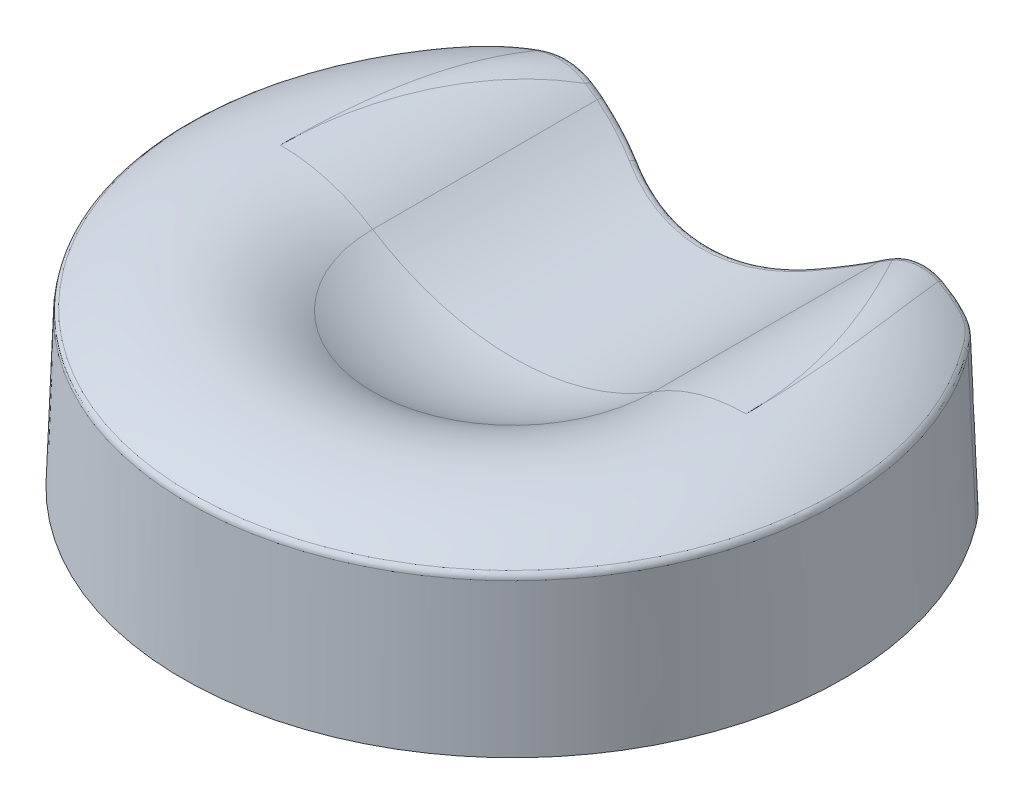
SolidWorks part; units mm, degrees
ref_plane "Front Plane" through (0, 0, 0) normal (0, 0, 1) x (1, 0, 0)
ref_plane "Top Plane" through (0, 0, 0) normal (0, 1, 0) x (1, 0, 0)
ref_plane "Right Plane" through (0, 0, 0) normal (1, 0, 0) x (0, 0, -1)
ref_plane "Plane1" through (0, -100, 0) normal (0, 1, 0) x (1, 0, 0)
sketch "Sketch2" plane through (0, 0, 0) normal (0, 0, 1) x (1, 0, 0)
  line L0 (-91.4776, 0) -> (91.4776, 0) construction
  line L1 (91.4776, 0) -> (211.4776, 0) construction
  line L2 (211.4776, 0) -> (214.9697, -100)
  line L3 (214.9697, -100) -> (0, -100)
  line L4 (0, -100) -> (0, -26.6818)
  arc A0 (-91.4776, 0) -> (91.4776, 0) centre (0, 143.473) ccw construction
  arc A1 (91.4776, 0) -> (211.4776, 0) centre (151.4776, -94.1037) cw
  arc A2 (0, -26.6818) -> (91.4776, 0) centre (0, 143.473) ccw
  dimension "D1" = 182.9552
  dimension "D2" = 170.1548
  dimension "D3" = 120
  dimension "D4" = 100
  dimension "D5" = 88
revolve "Revolve1" add sketch "Sketch2" angle 360 about L4
sketch "Sketch3" plane through (0, -100, 0) normal (0, 1, 0) x (1, 0, 0)
  line L0 (0, 0) -> (0, 239.2054) construction
  line L1 (202.2251, 144.2054) -> (-202.2251, 144.2054) construction
  line L2 (190, 119.2054) -> (190, 239.2054)
  line L3 (190, 239.2054) -> (-187.2101, 239.2054)
  line L4 (-187.2101, 239.2054) -> (-187.2101, 119.2054)
  arc A0 (60, 144.2054) -> (-60, 144.2054) centre (0, 265.1392) cw
  arc A1 (60, 144.2054) -> (190, 119.2054) centre (108.5755, 46.2982) cw
  arc A3 (-60, 144.2054) -> (-187.2101, 119.2054) centre (-107.3184, 48.8321) ccw
  point P5 (0, 130.1392)
  point P6 (0, 144.2054)
  dimension "D1" = 239.2054
  dimension "D3" = 120
  dimension "D4" = 135
  dimension "D5" = 120
  dimension "D2" = 95
  dimension "D6" = 190
extrude "Cut-Extrude1" cut sketch "Sketch3" along normal through all draft 2
sketch "Sketch4" plane through (0, 0, 0) normal (0, 0, 1) x (1, 0, 0)
  line L1 (151.4776, 17.5005) -> (-151.4776, 17.5005)
  arc A0 (-91.4776, 0) -> (-151.4776, 17.5005) centre (-151.4776, -94.1037) ccw construction
  arc A1 (-91.4776, 0) -> (91.4776, 0) centre (0, 143.473) ccw construction
  arc A2 (151.4776, 17.5005) -> (91.4776, 0) centre (151.4776, -94.1037) ccw construction
  arc A3 (-91.4776, 0) -> (-151.4776, 17.5005) centre (-151.4776, -94.1037) ccw
  arc A4 (-91.4776, 0) -> (91.4776, 0) centre (0, 143.473) ccw
  arc A5 (151.4776, 17.5005) -> (91.4776, 0) centre (151.4776, -94.1037) ccw
extrude "Cut-Extrude2" cut sketch "Sketch4" against normal through all
fillet "Fillet1" radius 35 2 edges at (-150.5943, 17.497, -23.1344) (150.5943, 17.497, -23.1344)
fillet "Fillet2" radius 60 2 edges
fillet "Fillet3" radius 5 12 edges at (111.3024, 8.1012, -151.783) (-13.5322, -26.1428, -128.2272) (-116.3146, 8.692, -151.108)
sketch "Sketch5" plane through (0, -100, 0) normal (0, 1, 0) x (1, 0, 0)
  line L0 (91, 0) -> (-91, 0) construction
  circle A0 centre (91, 0) radius 32.5
  circle A1 centre (-91, 0) radius 32.5
  dimension "D1" = 65
  dimension "D2" = 182
extrude "Boss-Extrude1" add sketch "Sketch5" against normal blind 20 draft 10
